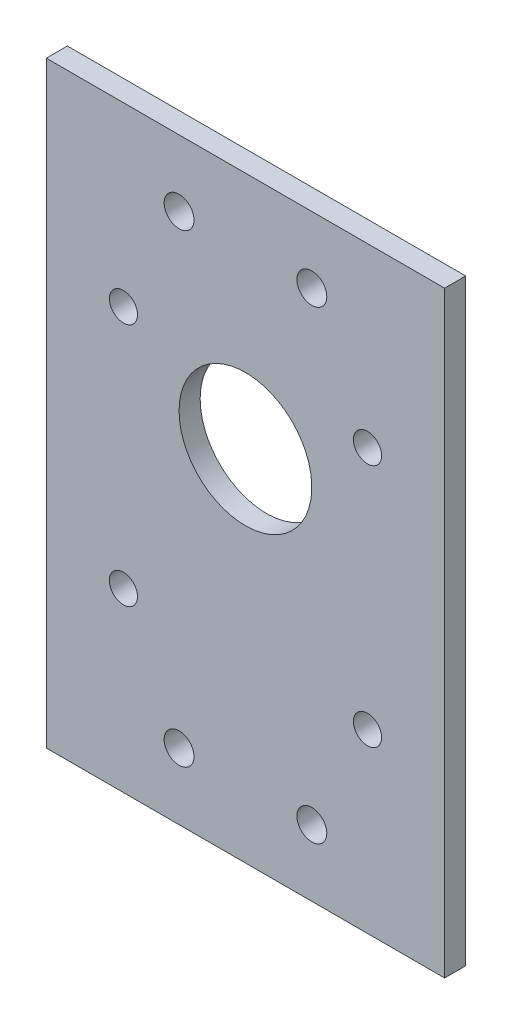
SolidWorks part; units mm, degrees
ref_plane "Front Plane" through (0, 0, 0) normal (1, 0, 0) x (0, 1, 0)
ref_plane "Top Plane" through (0, 0, 0) normal (0, 0, 1) x (0, 1, 0)
ref_plane "Right Plane" through (0, 0, 0) normal (0, 1, 0) x (-1, 0, 0)
sketch "Sketch1" plane through (0, 0, 0) normal (0, 0, 1) x (0, 1, 0)
  line L1 (-90, 60) -> (90, 60)
  line L2 (-90, 60) -> (-90, -60)
  line L3 (-90, -60) -> (90, -60)
  line L4 (90, 60) -> (90, -60)
  line L5 (-90, 60) -> (90, -60) construction
  line L6 (-90, -60) -> (90, 60) construction
  point P0 (0, 0)
  dimension "D1" = 120
  dimension "D2" = 180
extrude "Base Plate" add sketch "Sketch1" along normal mid plane 6.35
sketch "M_Pattern" plane through (0, 0, 3.175) normal (0, 0, 1) x (1, 0, 0)
  line L0 (-36.77, 36.77) -> (36.77, 36.77) construction
  line L1 (-36.77, 36.77) -> (-36.77, -36.77) construction
  circle A0 centre (-36.77, 36.77) radius 4.25
  circle A1 centre (36.77, 36.77) radius 4.25
  circle A2 centre (36.77, -36.77) radius 4.25
  circle A3 centre (-36.77, -36.77) radius 4.25
  point P0 (0, 0)
  dimension "D3" = 8.5
  dimension "D1" = 36.77
  dimension "D2" = 36.77
  dimension "D6" = 73.54
  dimension "D7" = 73.54
  dimension "D4" = 2
  dimension "D5" = 2
sketch "F_Pattern" plane through (0, 0, 3.175) normal (0, 0, 1) x (1, 0, 0)
  line L0 (-20, 70) -> (20, 70) construction
  line L1 (-20, 70) -> (-20, -70) construction
  line L2 (-20, -70) -> (20, -70) construction
  circle A0 centre (-20, 70) radius 4.5
  circle A1 centre (20, 70) radius 4.5
  circle A2 centre (20, -70) radius 4.5
  circle A3 centre (-20, -70) radius 4.5
  point P0 (0, 0)
  dimension "D1" = 9
  dimension "D2" = 20
  dimension "D3" = 70
  dimension "D6" = 40
  dimension "D7" = 140
  dimension "D4" = 2
  dimension "D5" = 2
extrude "M-Pattern" cut sketch "M_Pattern" against normal through all
extrude "F-Pattern" cut sketch "F_Pattern" against normal through all
sketch "Sketch2" plane through (0, 0, -3.175) normal (0, 0, -1) x (-1, 0, 0)
  circle A0 centre (-0.0004, 17.9996) radius 20
  point P0 (0, 0)
  point P1 (-0.0004, 17.9996)
  point P6 (-0.0004, 17.9996)
  dimension "D2" = 40
  dimension "D1" = 17.9996
extrude "Gearbox Clearance - DIA40 THRU" cut sketch "Sketch2" against normal through all
